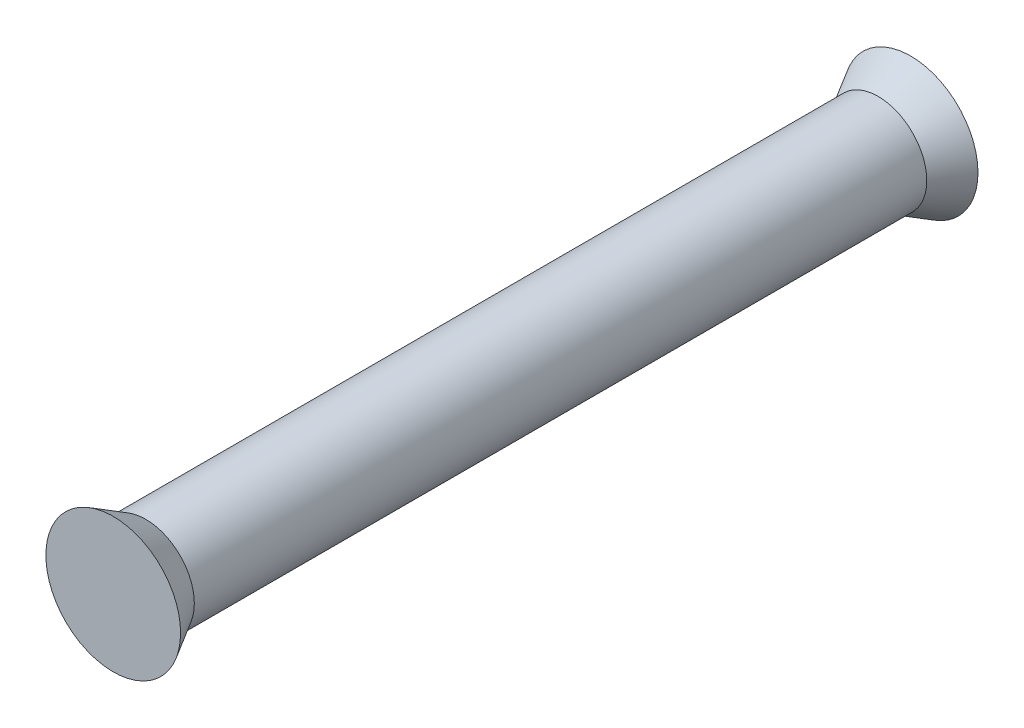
SolidWorks part; units mm, degrees
ref_plane "Спереди" through (0, 0, 0) normal (0, 0, 1) x (1, 0, 0)
ref_plane "Сверху" through (0, 0, 0) normal (0, 1, 0) x (1, 0, 0)
ref_plane "Справа" through (0, 0, 0) normal (1, 0, 0) x (0, 0, -1)
sketch "Эскиз1" plane through (0, 0, 0) normal (1, 0, 0) x (0, 0, -1)
  line L0 (0, 0) -> (68.9447, 0) construction
  line L1 (0, 0) -> (38.9636, 0)
  line L2 (38.9636, 0) -> (38.9636, 3.2914)
  line L3 (38.9636, 3.2914) -> (37.3761, 2.3749)
  line L4 (37.3761, 2.3749) -> (1.5875, 2.3749)
  line L5 (1.5875, 2.3749) -> (0, 3.2914)
  line L6 (0, 3.2914) -> (0, 0)
  dimension "D1" = 4.7498
  dimension "D2" = 30
  dimension "D3" = 1.5875
  dimension "D4" = 30
  dimension "D5" = 38.9636
  dimension "D6" = 1.5875
revolve "Повернуть1" add sketch "Эскиз1" angle 360 about L0
